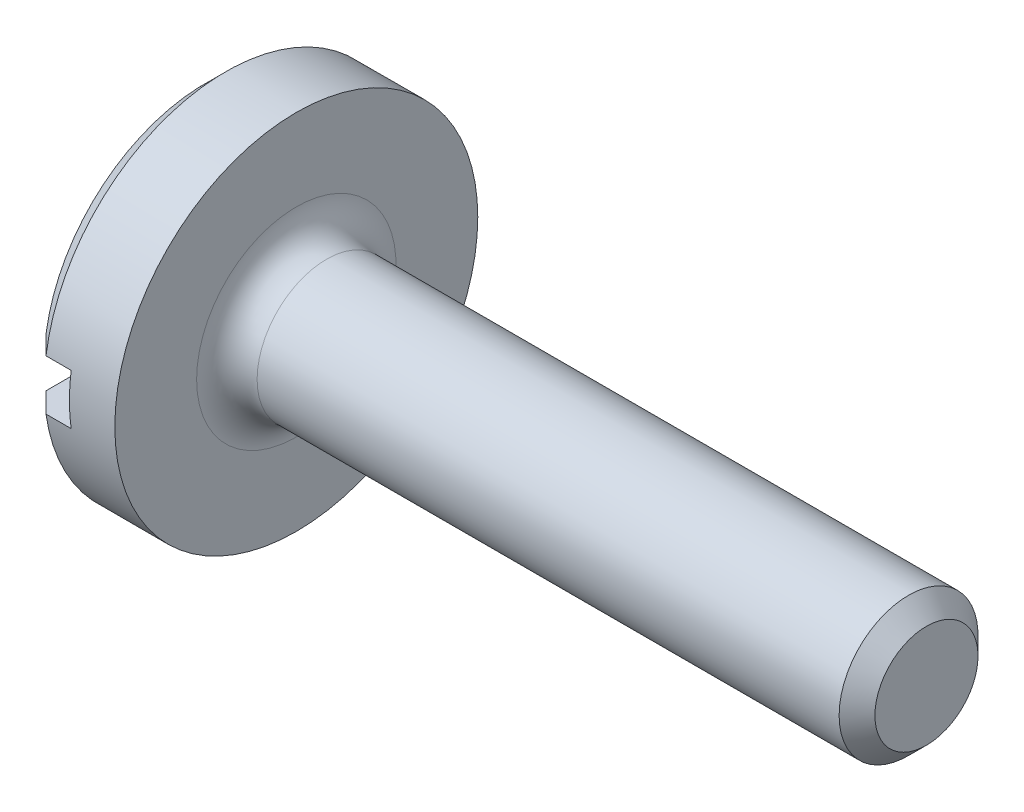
SolidWorks part; units mm, degrees
ref_plane "Plane1" through (0, 0, 0) normal (0, 0, 1) x (1, 0, 0)
ref_plane "Plane2" through (0, 0, 0) normal (0, 1, 0) x (1, 0, 0)
ref_plane "Plane3" through (0, 0, 0) normal (1, 0, 0) x (0, 0, -1)
sketch "BodySke" plane through (0, 0, 0) normal (0, 0, 1) x (1, 0, 0)
  line L0 (0.9144, 0.6998) -> (0.9144, 1.8288)
  line L1 (0, 0) -> (0, 1.6256)
  line L2 (-25.4, 0) -> (127, 0) construction
  line L3 (7.2644, 0) -> (0, 0)
  line L4 (0.9144, 0.6998) -> (7.0841, 0.6998)
  line L5 (7.2644, 0.5194) -> (7.2644, 0)
  line L6 (0.2032, 1.8288) -> (0.9144, 1.8288)
  line L7 (0.2032, 1.8288) -> (0, 1.6256)
  line L8 (7.0841, 0.6998) -> (7.2644, 0.5194)
  line L9 (1.1684, 0) -> (1.1684, 1.6256) construction
  line L10 (5.1021, 1.8288) -> (5.1021, -0.343) construction
  dimension "Head_ht" = 0.9144
  dimension "Diameter" = 1.3995
  dimension "Length" = 6.35
  dimension "Head_dia" = 3.6576
  dimension "Minor_dia" = 1.0389
  dimension "D6" = 45
  dimension "D7" = 45
  dimension "Head_chf_len" = 0.2032
  dimension "Advance" = 0.254
  dimension "Thread_nom" = 2.1623
revolve "Base-Revolve" add sketch "BodySke"
fillet "Fillet1" radius 0.3048 1 edges at (0.9144, 0, 0.6998)
ref_plane "Plane4" through (0.4572, 0, 0) normal (1, 0, 0) x (0, 0, -1)
sketch "Sketch2" plane through (0.4572, 0, 0) normal (1, 0, 0) x (0, 0, -1)
  line L0 (1.8288, -0.254) -> (-1.8288, -0.254)
  line L1 (1.8288, -0.254) -> (1.8288, 0.254)
  line L2 (-1.8288, 0.254) -> (1.8288, 0.254)
  line L3 (-1.8288, 0.254) -> (-1.8288, -0.254)
  dimension "D1" = 3.6576
  dimension "D2" = 1.8288
  dimension "Slot_width" = 0.508
  dimension "D3" = 0.254
extrude "Slot" cut sketch "Sketch2" against normal through all
sketch "ThdSchSke" plane through (0, 0, 0) normal (0, 0, 1) x (1, 0, 0)
  line L0 (5.1021, -0.5194) -> (4.9758, -0.6998)
  line L1 (5.1021, -0.5194) -> (5.2283, -0.6998)
  line L2 (5.2283, -0.6998) -> (5.2283, -0.8747)
  line L3 (-3.175, 0) -> (5.1513, 0) construction
  line L4 (0, -0.254) -> (0, -1.6256) construction
  line L5 (5.2283, -0.8747) -> (4.9758, -0.8747)
  line L6 (4.9758, -0.8747) -> (4.9758, -0.6998)
  dimension "Thread_minor" = 1.0389
  dimension "Diameter" = 1.3995
  dimension "Start" = 5.1021
  dimension "SideAngle" = 55
  dimension "VeeAngle" = 70
  dimension "Overcut" = 1.7494
revolve "ThreadSchematic" [suppressed] cut sketch "ThdSchSke" angle 360 about L3
pattern_linear "ThdSchPat" [suppressed]
equation "\"D1@Sketch2\" = \"Head_dia@BodySke\""
equation "\"D2@Sketch2\" = \"D1@Sketch2\" / 2"
equation "\"D3@Sketch2\" = \"Slot_width@Sketch2\" / 2"
equation "\"Thread_minor@ThreadCosmetic\" = \"Minor_dia@BodySke\""
equation "\"Thread_length@ThreadCosmetic\" = ((sgn( (\"Length@BodySke\" - \"Advance@BodySke\" ) - \"Thread_nom@BodySke\" )-1)*( (\"Length@BodySke\" - \"Advance@BodySke\" ) - \"Thread_nom@BodySke\" ))/-2+ \"Thread_nom@BodySke\""
equation "\"Thread_minor@ThdSchSke\" = \"Minor_dia@BodySke\""
equation "\"Diameter@ThdSchSke\" = \"Diameter@BodySke\""
equation "\"Overcut@ThdSchSke\" = \"Diameter@BodySke\" * 1.25"
equation "\"Start@ThdSchSke\" = \"Head_ht@BodySke\" + \"Length@BodySke\" - \"Thread_length@ThreadCosmetic\"  '---Non-countersunk---"
equation "\"Num_threads@ThdSchPat\" = int( \"Thread_length@ThreadCosmetic\" / \"Advance@BodySke\" + 0.999 )  + 1"
equation "\"Advance@ThdSchPat\" = \"Thread_length@ThreadCosmetic\" /  (\"Num_threads@ThdSchPat\" - 1) 'relax it"
equation "\"Num_threads@ThdSchPat\" = \"Num_threads@ThdSchPat\" - sgn( \"Num_threads@ThdSchPat\" - 1) '---chamfered tips only---"
